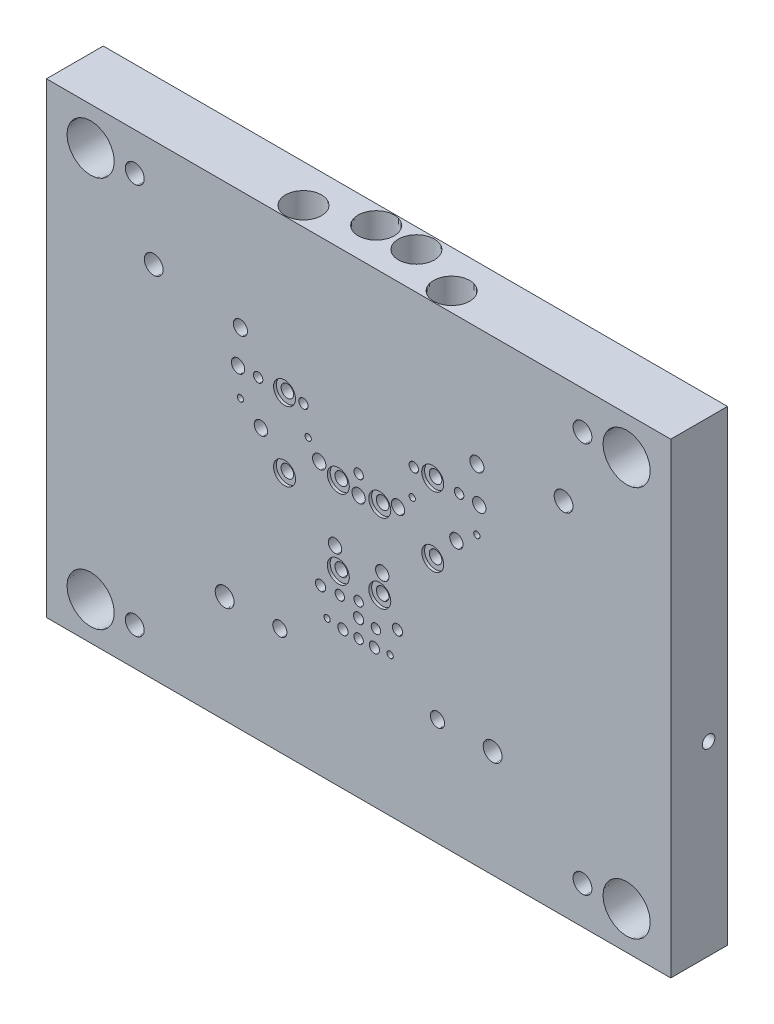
SolidWorks part; units mm, degrees
ref_plane "Plan de face" through (0, 0, 0) normal (0, 0, 1) x (1, 0, 0)
ref_plane "Plan de dessus" through (0, 0, 0) normal (0, 1, 0) x (1, 0, 0)
ref_plane "Plan de droite" through (0, 0, 0) normal (1, 0, 0) x (0, 0, -1)
imported_body "Importée1"
sketch "Esquisse1" plane through (0, 0, -92) normal (0, 0, -1) x (-1, 0, 0)
  circle A0 centre (75, 33.9925) radius 2 construction
  circle A1 centre (75, 33.9925) radius 2
  circle A2 centre (32, 33.9925) radius 2 construction
  circle A3 centre (32, 33.9925) radius 2
  circle A4 centre (-34, 33.9925) radius 2 construction
  circle A5 centre (-34, 33.9925) radius 2
  circle A6 centre (-75, 33.9925) radius 2 construction
  circle A7 centre (-75, 33.9925) radius 2
extrude "Enlèv. mat.-Extru.1" cut sketch "Esquisse1" against normal through all
sketch "Esquisse2" plane through (0, 0, -92) normal (0, 0, -1) x (-1, 0, 0)
  circle A0 centre (80, 36.261) radius 2 construction
  circle A1 centre (80, 36.261) radius 2
  circle A2 centre (36, 36.261) radius 2 construction
  circle A3 centre (36, 36.261) radius 2
  circle A4 centre (-80, 36.261) radius 2 construction
  circle A5 centre (-80, 36.261) radius 2
extrude "Extrusion1" add sketch "Esquisse2" against normal blind 30
sketch "Esquisse3" plane through (0, 0, -92) normal (0, 0, -1) x (-1, 0, 0)
  arc A0 (-34.0181, 35.9924) -> (-35.9819, 34.2611) centre (-36, 36.261) ccw
  arc A1 (-34.0181, 35.9924) -> (-35.9819, 34.2611) centre (-34, 33.9925) ccw
  dimension "D1" = 2
  dimension "D2" = 2
extrude "Extrusion2" add sketch "Esquisse3" against normal blind 30
sketch "Esquisse4" plane through (0, 0, -56) normal (0, 0, 1) x (1, 0, 0)
  circle A0 centre (-80, 36.261) radius 2
  circle A1 centre (-36, 36.261) radius 2
  circle A2 centre (80, 36.261) radius 2
  arc A3 (35.9819, 34.2611) -> (34.0181, 35.9924) centre (36, 36.261) ccw construction
  circle A4 centre (36, 36.261) radius 2
  dimension "D1" = 4
  dimension "D2" = 4
  dimension "D3" = 4
extrude "Enlèv. mat.-Extru.2" cut sketch "Esquisse4" against normal up to surface (36 mm away)
sketch "Esquisse5" plane through (0, 0, -56) normal (0, 0, 1) x (1, 0, 0)
  circle A0 centre (-36, 36.261) radius 2 construction
  circle A1 centre (-36, 36.261) radius 2
  circle A2 centre (-80, 36.261) radius 2 construction
  circle A3 centre (-80, 36.261) radius 2
  circle A4 centre (80, 36.261) radius 2 construction
  circle A5 centre (80, 36.261) radius 2
  arc A6 (35.9819, 34.2611) -> (34.0181, 35.9924) centre (36, 36.261) ccw construction
  arc A7 (35.9819, 34.2611) -> (34.0181, 35.9924) centre (36, 36.261) ccw
  circle A8 centre (30.5, -19.015) radius 2.5 construction
  circle A9 centre (30.5, -19.015) radius 2.5
  circle A10 centre (-28.5, -19.515) radius 3 construction
  circle A11 centre (-28.5, -19.515) radius 3
  arc A14 (34.0181, 35.9924) -> (35.9819, 34.2611) centre (34, 33.9925) ccw construction
  arc A15 (35.9819, 34.2611) -> (34.0181, 35.9924) centre (34, 33.9925) ccw
extrude "Extrusion3" add sketch "Esquisse5" against normal up to surface (36 mm away)
